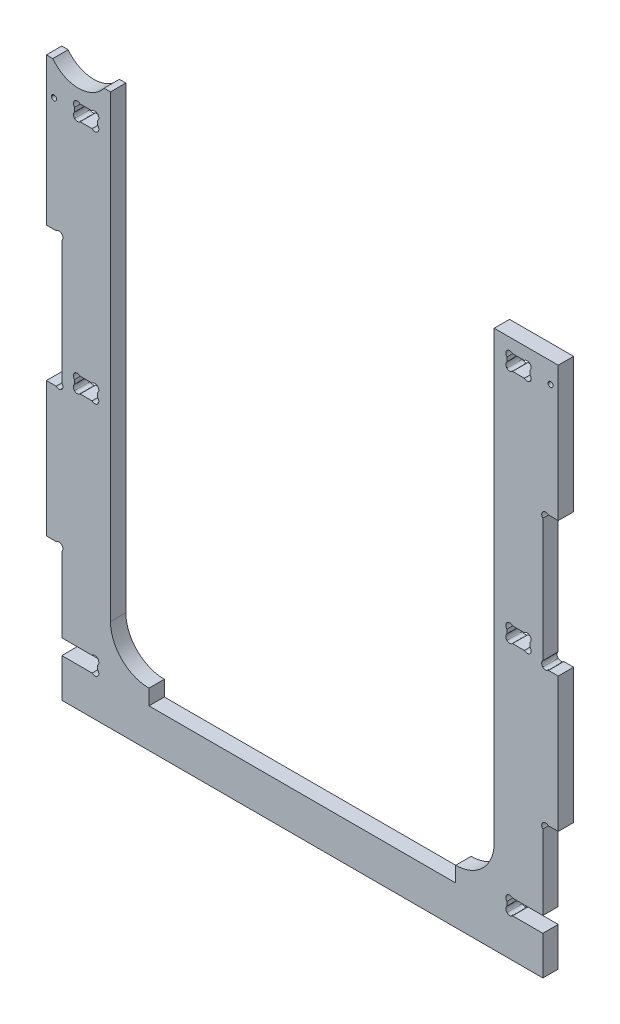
SolidWorks part; units mm, degrees
ref_plane "Plan de face" through (0, 0, 0) normal (0, 0, 1) x (1, 0, 0)
ref_plane "Plan de dessus" through (0, 0, 0) normal (0, 1, 0) x (1, 0, 0)
ref_plane "Plan de droite" through (0, 0, 0) normal (1, 0, 0) x (0, 0, -1)
body saved out of another part "Stock-Pièce3-1"
sketch "Esquisse1" plane through (0, 0, 6) normal (0, 0, 1) x (1, 0, 0)
  line L0 (2320.1403, -187.2762) -> (2315.5243, -187.2762) construction
  line L1 (2317.8323, -187.2762) -> (2296.7331, -187.2762)
  line L2 (2317.8323, -187.2762) -> (2317.8323, -193.2762)
  line L3 (2317.8323, -193.2762) -> (2296.7331, -193.2762)
  line L4 (2296.7331, -187.2762) -> (2296.7331, -193.2762)
  line L5 (2315.5243, -193.2762) -> (2320.1403, -193.2762) construction
  line L6 (2484.1661, -187.2762) -> (2488.782, -187.2762) construction
  line L7 (2486.474, -187.2762) -> (2503.3557, -187.2762)
  line L8 (2486.474, -187.2762) -> (2486.474, -193.2762)
  line L9 (2486.474, -193.2762) -> (2503.3557, -193.2762)
  line L10 (2503.3557, -187.2762) -> (2503.3557, -193.2762)
  line L11 (2488.782, -193.2762) -> (2484.1661, -193.2762) construction
  point P14 (2486.474, -193.2762)
extrude "Enlèv. mat.-Extru.1" cut sketch "Esquisse1" against normal through all
sketch "Esquisse2" plane through (0, 0, 6) normal (0, 0, 1) x (1, 0, 0)
  line L0 (2484.1661, -187.2762) -> (2488.782, -187.2762) construction
  line L1 (2486.474, -187.2762) -> (2492.0401, -187.2762)
  line L2 (2486.474, -187.2762) -> (2486.474, -184.5873)
  line L3 (2486.474, -184.5873) -> (2492.0401, -184.5873)
  line L4 (2492.0401, -187.2762) -> (2492.0401, -184.5873)
  line L5 (2490.974, -193.2762) -> (2495.974, -193.2762) construction
  line L6 (2493.474, -193.2762) -> (2486.474, -193.2762)
  line L7 (2493.474, -193.2762) -> (2493.474, -196.0135)
  line L8 (2493.474, -196.0135) -> (2486.474, -196.0135)
  line L9 (2486.474, -193.2762) -> (2486.474, -196.0135)
  line L10 (2320.1403, -187.2762) -> (2315.5243, -187.2762) construction
  line L11 (2317.8323, -187.2762) -> (2311.2261, -187.2762)
  line L12 (2317.8323, -187.2762) -> (2317.8323, -184.5873)
  line L13 (2317.8323, -184.5873) -> (2311.2261, -184.5873)
  line L14 (2311.2261, -187.2762) -> (2311.2261, -184.5873)
  line L15 (2315.5243, -193.2762) -> (2320.1403, -193.2762) construction
  line L16 (2317.8323, -193.2762) -> (2311.2261, -193.2762)
  line L17 (2317.8323, -193.2762) -> (2317.8323, -196.0135)
  line L18 (2317.8323, -196.0135) -> (2311.2261, -196.0135)
  line L19 (2311.2261, -193.2762) -> (2311.2261, -196.0135)
extrude "Boss.-Extru.1" add sketch "Esquisse2" against normal up to surface (6 mm away)
